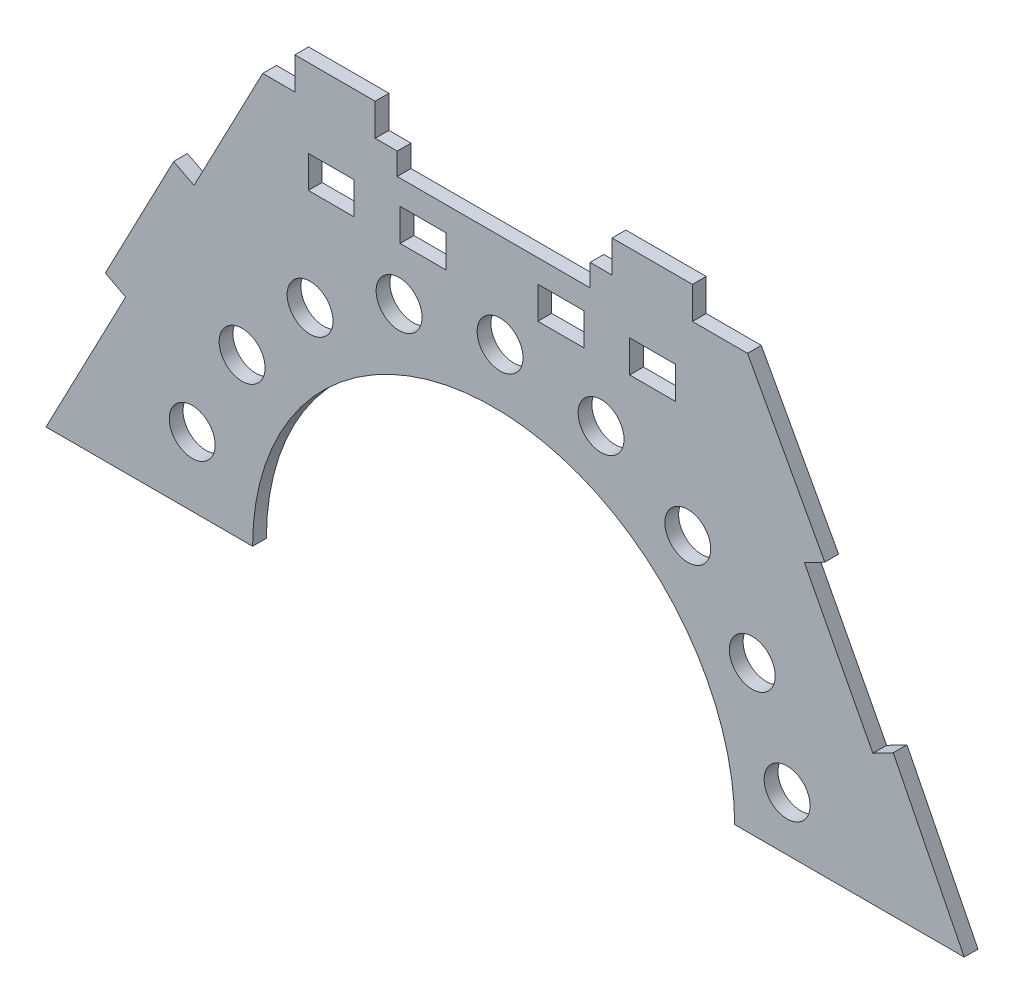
SolidWorks part; units mm, degrees
ref_plane "Alzado" through (0, 0, 0) normal (0, 0, 1) x (1, 0, 0)
ref_plane "Planta" through (0, 0, 0) normal (0, 1, 0) x (1, 0, 0)
ref_plane "Vista lateral" through (0, 0, 0) normal (1, 0, 0) x (0, 0, -1)
sketch "Sketch2" plane through (0, 0, 0) normal (0, 0, 1) x (1, 0, 0)
  line L0 (-52.5, 0) -> (52.5, 0)
  line L1 (-52.5, 0) -> (-97.5, 0)
  line L2 (52.5, 0) -> (97.5, 0)
  line L3 (-21, 85.5) -> (21, 85.5)
  line L4 (21, 85.5) -> (21, 90.3)
  line L5 (21, 90.3) -> (25.8, 90.3)
  line L6 (25.8, 90.3) -> (25.8, 97.3)
  line L7 (25.8, 97.3) -> (43.3, 97.3)
  line L8 (43.3, 97.3) -> (43.3, 90.3)
  line L9 (-21, 85.5) -> (-21, 90.3)
  line L10 (-21, 90.3) -> (-25.8, 90.3)
  line L11 (-25.8, 90.3) -> (-25.8, 97.3)
  line L12 (-25.8, 97.3) -> (-43.3, 97.3)
  line L13 (-43.3, 97.3) -> (-43.3, 90.3)
  line L14 (-43.3, 90.3) -> (-50.3, 90.3)
  line L15 (43.3, 90.3) -> (50.3, 90.3)
  line L16 (-97.5, 0) -> (-50.3, 90.3)
  line L17 (97.5, 0) -> (50.3, 90.3)
  line L18 (-80.1547, 33.1838) -> (-84.5859, 35.5)
  line L19 (-65.2577, 61.6838) -> (-69.6889, 64)
  line L20 (-69.6889, 64) -> (-84.5859, 35.5)
  line L21 (97.5, 0) -> (102.5, 0)
  line L22 (82.603, 28.5) -> (87.0342, 30.8162)
  line L23 (87.0342, 30.8162) -> (102.5, 0)
  line L24 (67.706, 57) -> (72.1372, 59.3162)
  line L25 (50.3, 90.3) -> (55.3, 90.3)
  line L26 (55.3, 90.3) -> (72.1372, 59.3162)
  line L27 (50.3, 90.3) -> (55.3, 90.3)
  line L28 (-40.3643, 80.1873) -> (-30.3643, 80.1873)
  line L29 (-40.3643, 80.1873) -> (-40.3643, 73.1873)
  line L30 (-40.3643, 73.1873) -> (-30.3643, 73.1873)
  line L31 (-30.3643, 80.1873) -> (-30.3643, 73.1873)
  line L32 (-20.3643, 80.1873) -> (-10.3643, 80.1873)
  line L33 (-20.3643, 80.1873) -> (-20.3643, 73.1873)
  line L34 (-20.3643, 73.1873) -> (-10.3643, 73.1873)
  line L35 (-10.3643, 80.1873) -> (-10.3643, 73.1873)
  line L36 (9.6357, 80.5064) -> (19.6357, 80.5064)
  line L37 (9.6357, 80.5064) -> (9.6357, 73.5064)
  line L38 (9.6357, 73.5064) -> (19.6357, 73.5064)
  line L39 (19.6357, 80.5064) -> (19.6357, 73.5064)
  line L40 (29.6357, 80.3787) -> (39.6357, 80.3787)
  line L41 (29.6357, 80.3787) -> (29.6357, 73.3787)
  line L42 (29.6357, 73.3787) -> (39.6357, 73.3787)
  line L43 (39.6357, 80.3787) -> (39.6357, 73.3787)
  arc A0 (52.5, 0) -> (-52.5, 0) centre (0, 0) ccw
  circle A1 centre (-65.6586, 15) radius 5
  circle A2 centre (-54.787, 34.9769) radius 5
  circle A3 centre (-39.9814, 51.2493) radius 5
  circle A4 centre (-20.5956, 61.6508) radius 5
  circle A5 centre (1.4044, 65) radius 5
  circle A6 centre (23.4044, 60.6402) radius 5
  circle A7 centre (42.2922, 49.3596) radius 5
  circle A8 centre (56.3351, 32.4245) radius 5
  circle A9 centre (63.9245, 11.7751) radius 5
  point P6 (0, 0)
  point P10 (0, 85.5)
  point P11 (0, 52.5)
  point P35 (-51.5648, 9.8654)
  dimension "D1" = 105
  dimension "D29" = 10
  dimension "D31" = 15
  dimension "D33" = 10
  dimension "D36" = 10
  dimension "D39" = 10
  dimension "D42" = 10
  dimension "D43" = 65
  dimension "D45" = 10
  dimension "D48" = 10
  dimension "D51" = 10
  dimension "D54" = 10
  dimension "D2" = 45
  dimension "D3" = 45
  dimension "D4" = 42
  dimension "D5" = 33
  dimension "D6" = 4.8
  dimension "D7" = 4.8
  dimension "D8" = 7
  dimension "D9" = 17.5
  dimension "D10" = 85.5
  dimension "D11" = 4.8
  dimension "D12" = 4.8
  dimension "D13" = 7
  dimension "D14" = 17.5
  dimension "D15" = 7
  dimension "D16" = 7
  dimension "D17" = 9.8995
  dimension "D18" = 9.8995
  dimension "D19" = 35.5
  dimension "D20" = 5
  dimension "D21" = 28.5
  dimension "D22" = 5
  dimension "D23" = 5
  dimension "D24" = 28.5
  dimension "D25" = 34.4794
  dimension "D26" = 5
  dimension "D27" = 5
  dimension "D28" = 28.5
  dimension "D30" = 15
  dimension "D32" = 31.8414
  dimension "D34" = 65
  dimension "D35" = 34.9769
  dimension "D37" = 22
  dimension "D38" = 65
  dimension "D40" = 22
  dimension "D41" = 65
  dimension "D44" = 22
  dimension "D46" = 22
  dimension "D47" = 65
  dimension "D49" = 22
  dimension "D50" = 65
  dimension "D52" = 22
  dimension "D53" = 65
  dimension "D55" = 65
  dimension "D56" = 22
  dimension "D57" = 7
  dimension "D58" = 10
  dimension "D59" = 7
  dimension "D60" = 10
  dimension "D61" = 7
  dimension "D62" = 10
  dimension "D63" = 10
  dimension "D64" = 7
  dimension "D65" = 10
  dimension "D66" = 20
  dimension "D67" = 10
  dimension "D68" = 10.6643
  dimension "D69" = 0
  dimension "D70" = 40.028
  dimension "D71" = 73.3787
  dimension "D72" = 73.5064
extrude "Boss-Extrude3" add sketch "Sketch2" along normal blind 3 contours L19 L20 L18 L16 | A0 L2 L17 L15 L8 L7 L6 L5 L4 L3 L9 L10 L11 L12 L13 L14 L16 L1 A9 A8 A7 A6 A5 A4 A3 A2 A1 L28 L31 L30 L29 L32 L35 L34 L33 | L26 L25 L17 L24 | L23 L22 L17 L21
